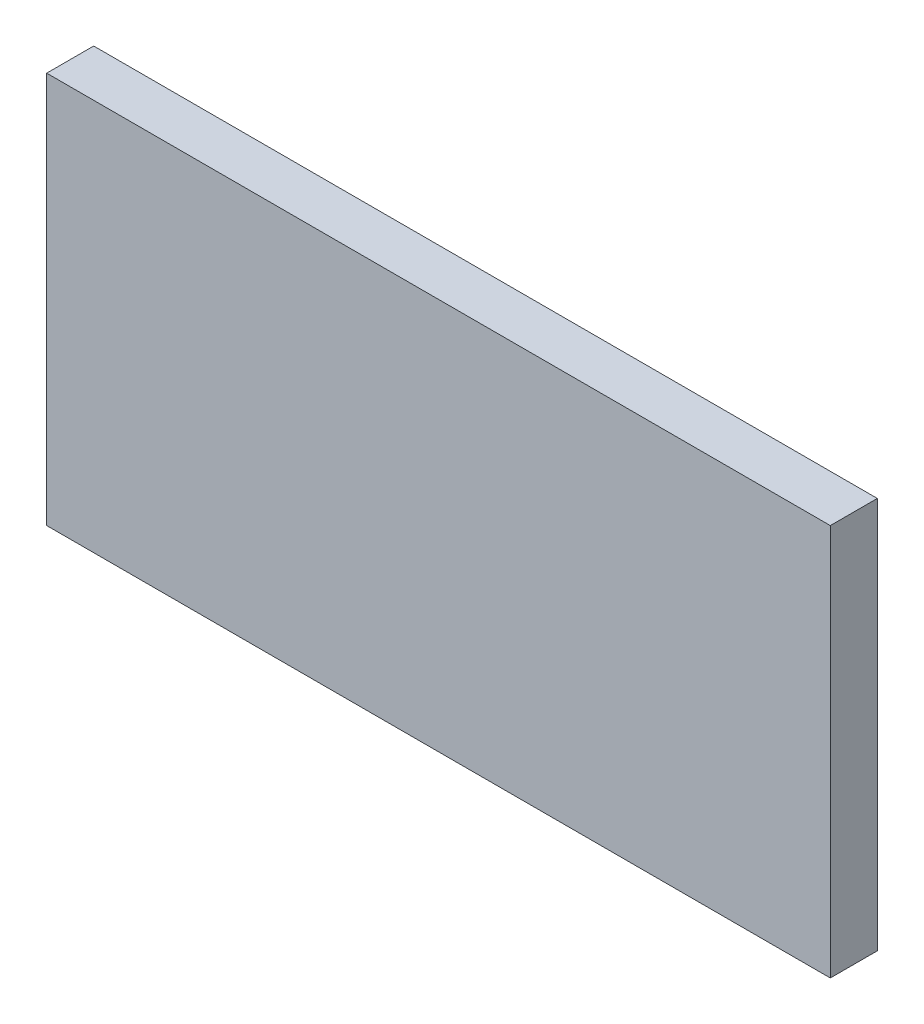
SolidWorks part; units mm, degrees
ref_plane "Front" through (0, 0, 0) normal (0, 0, 1) x (1, 0, 0)
ref_plane "Top" through (0, 0, 0) normal (0, 1, 0) x (1, 0, 0)
ref_plane "Right" through (0, 0, 0) normal (1, 0, 0) x (0, 0, -1)
sketch "Sketch1" plane through (0, 0, 0) normal (0, 0, 1) x (1, 0, 0)
  line L1 (0, 0) -> (50, 0)
  line L2 (0, 0) -> (0, 25)
  line L3 (0, 25) -> (50, 25)
  line L4 (50, 0) -> (50, 25)
  dimension "D1" = 50
  dimension "D2" = 25
extrude "Extrude1" add sketch "Sketch1" along normal blind 3
sketch "Sketch2" plane through (0, 0, 3) normal (0, 0, 1) x (1, 0, 0)
  line L0 (9.7511, 15.2961) -> (26.596, 15.2961)
  line L3 (50, 25) -> (0, 25) construction
